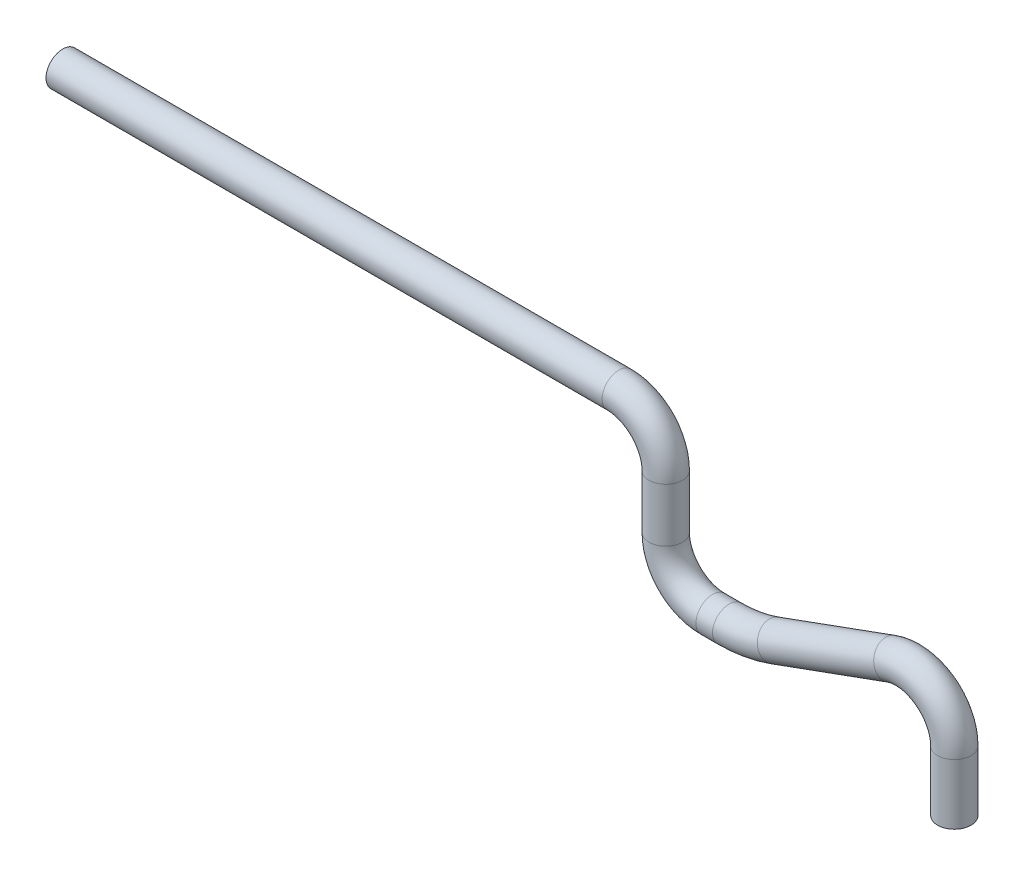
SolidWorks part; units mm, degrees
ref_plane "Face" through (0, 0, 0) normal (0, 0, 1) x (1, 0, 0)
ref_plane "Dessus" through (0, 0, 0) normal (0, 1, 0) x (1, 0, 0)
ref_plane "Droite" through (0, 0, 0) normal (1, 0, 0) x (0, 0, -1)
sketch "Esquisse1" plane through (0, 0, 0) normal (0, 0, 1) x (1, 0, 0)
  line L0 (-35, 0) -> (-7, 0)
  line L1 (0, -7) -> (0, -15)
  line L2 (7, -22) -> (9.4735, -22)
  line L3 (16.3139, -20.7939) -> (33.676, -14.4745)
  line L4 (43.0702, -21.0524) -> (43.0702, -30.0554)
  arc A0 (33.676, -14.4745) -> (43.0702, -21.0524) centre (36.0702, -21.0524) cw
  arc A1 (16.3139, -20.7939) -> (9.4735, -22) centre (9.4735, -2) cw
  arc A2 (0, -15) -> (7, -22) centre (7, -15) ccw
  arc A3 (-7, 0) -> (0, -7) centre (-7, -7) cw
  point P9 (43.0702, -11.0554)
  point P12 (13, -22)
  point P15 (0, -22)
  point P18 (0, 0)
  dimension "D6" = 7
  dimension "D8" = 20
  dimension "D9" = 7
  dimension "D1" = 35
  dimension "D2" = 22
  dimension "D3" = 13
  dimension "D4" = 32
  dimension "D5" = 19
  dimension "D7" = 200
ref_plane "Plan1" through (-35, 0, 0) normal (1, 0, 0) x (0, 0, -1)
sketch "Esquisse2" plane through (-35, 0, 0) normal (1, 0, 0) x (0, 0, -1)
  circle A0 centre (0, 0) radius 2.5
  dimension "D1" = 5
sweep "Base-Balayage" add profiles "Esquisse2" path "Esquisse1"
sketch "Esquisse4" plane through (0, 0, 0) normal (0, 1, 0) x (1, 0, 0)
  line L0 (-35, 0) -> (-90, 0)
  line L1 (-35, -6.1531) -> (-35, 6.1531) construction
  line L2 (-7, 0) -> (-35, 0) construction
  dimension "D1" = 55
  dimension "D2" = 180
sketch "Esquisse5" plane through (-35, 0, 0) normal (-1, 0, 0) x (0, 0, 1)
  circle A1 centre (0, 0) radius 2.5
  circle A2 centre (0, 0) radius 2.5
  dimension "D1" = 0
sweep "Boss.-Balayage1" add profiles "Esquisse5" path "Esquisse4"
sketch "Esquisse6" plane through (0, 0, 0) normal (0, 1, 0) x (1, 0, 0)
  line L0 (-90, 7.9858) -> (-88.1198, 16.8315)
  line L1 (-90, 2.5) -> (-90, -2.5) construction
  line L4 (-88.1198, 16.8315) -> (-99.2104, 19.1889)
  line L5 (-99.2104, 19.1889) -> (-90, 7.9858)
  dimension "D1" = 12
